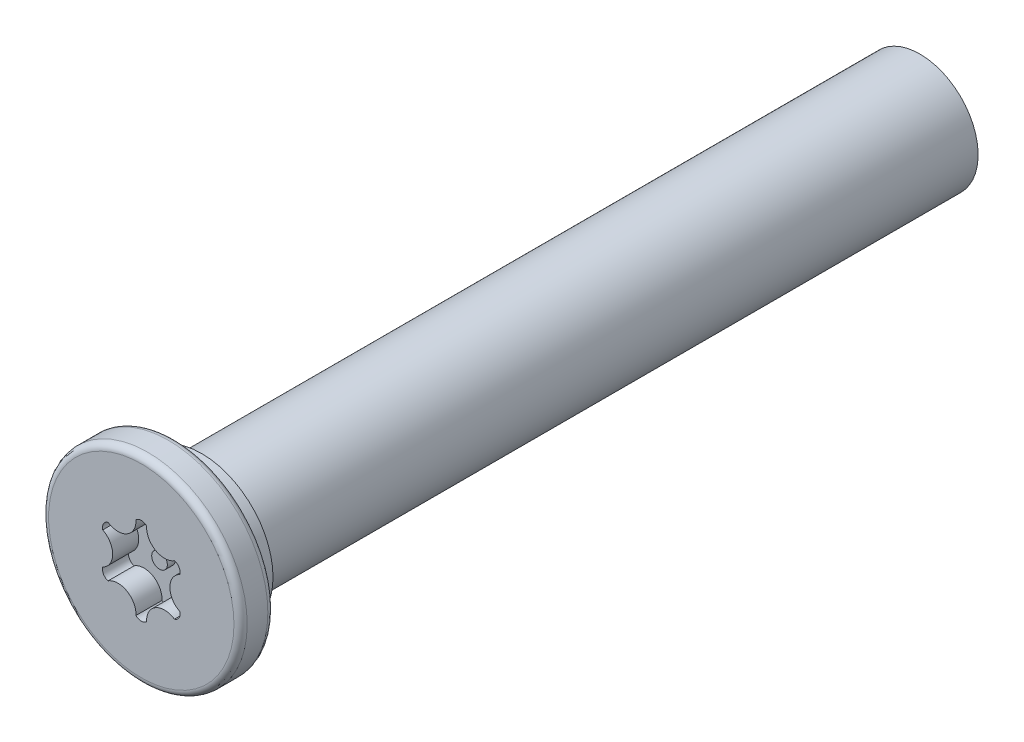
SolidWorks part; units mm, degrees
ref_plane "Front Plane" through (0, 0, 0) normal (0, 0, 1) x (1, 0, 0)
ref_plane "Top Plane" through (0, 0, 0) normal (0, 1, 0) x (1, 0, 0)
ref_plane "Right Plane" through (0, 0, 0) normal (1, 0, 0) x (0, 0, -1)
sketch "Sketch2" plane through (0, 0, 0) normal (1, 0, 0) x (0, 0, -1)
  line L1 (0, 0) -> (1.3, 0)
  line L2 (0, 0) -> (0, 3.81)
  line L3 (0, 3.81) -> (1.3, 3.81)
  line L4 (1.3, 0) -> (1.3, 3.81)
  line L5 (1.3, 0) -> (14, 0)
  line L6 (1.3, 0) -> (1.3, 2.23)
  line L7 (1.3, 2.23) -> (14, 2.23)
  line L8 (14, 0) -> (14, 2.23)
  dimension "D1" = 3.81
  dimension "D2" = 1.3
  dimension "D3" = 12.7
  dimension "D4" = 2.23
revolve "Revolve1" add sketch "Sketch2" angle 360 about L5
sketch "Sketch3" plane through (0, 0, 0) normal (0, 0, 1) x (1, 0, 0)
  line L0 (0, 1.3843) -> (0, 0)
  line L3 (1.1845, -1.0048) -> (2.4257, -1.0048)
  line L4 (0, 1.675) -> (0, 1.6727)
  line L5 (0, 1.675) -> (0, 1.6727)
  line L6 (0, 1.6727) -> (0, 1.675)
  line L8 (1.0407, 1.8026) -> (1.1012, 1.9073)
  line L9 (1.3857, 1.205) -> (2.5818, 1.205)
  line L10 (0, 0) -> (0.8375, 1.4506)
  line L11 (0, 0) -> (2.5818, 0)
  line L14 (2.5818, 0) -> (2.5818, 1.205)
  line L15 (1.3857, 1.205) -> (-0.1691, 1.205)
  circle A0 centre (0, 0) radius 1.675
  arc A7 (1.1845, -1.0048) -> (1.0345, -1.0748) centre (0.8546, -0.4934) cw
  arc A16 (-0.2051, 1.5894) -> (0.2051, 1.5894) centre (0, 1.3843) cw
  arc A18 (0.2051, 1.5894) -> (1.2739, 0.9723) centre (0.8938, 1.5482) ccw
  arc A19 (1.479, 0.6171) -> (1.479, -0.6171) centre (1.7877, 0) ccw
  arc A20 (1.2739, 0.9723) -> (1.479, 0.6171) centre (1.1988, 0.6922) cw
  arc A21 (1.2739, -0.9723) -> (0.2051, -1.5894) centre (0.8938, -1.5482) ccw
  arc A22 (1.479, -0.6171) -> (1.2739, -0.9723) centre (1.1988, -0.6922) cw
  arc A23 (-0.2051, -1.5894) -> (-1.2739, -0.9723) centre (-0.8938, -1.5482) ccw
  arc A24 (0.2051, -1.5894) -> (-0.2051, -1.5894) centre (0, -1.3843) cw
  arc A25 (-1.479, -0.6171) -> (-1.479, 0.6171) centre (-1.7877, 0) ccw
  arc A26 (-1.2739, -0.9723) -> (-1.479, -0.6171) centre (-1.1988, -0.6922) cw
  arc A27 (-1.2739, 0.9723) -> (-0.2051, 1.5894) centre (-0.8938, 1.5482) ccw
  arc A28 (-1.479, 0.6171) -> (-1.2739, 0.9723) centre (-1.1988, 0.6922) cw
  point P38 (0, 0)
  point P52 (0, 0)
  dimension "D1" = 3.35
  dimension "D4" = 1.205
  dimension "D2" = 6
  dimension "D5" = 60
extrude "Cut-Extrude3" cut sketch "Sketch3" against normal blind 1
fillet "Fillet12" radius 0.254 2 edges at (3.81, 0, 0) (3.81, 0, -1.3)
sketch "Sketch7" plane through (0, 0, -14) normal (0, 0, -1) x (-1, 0, 0)
  circle A0 centre (0, 0) radius 2.23
  dimension "D1" = 4.46
extrude "Cut-Extrude6" cut sketch "Sketch7" against normal blind 12.7
sketch "Sketch11" plane through (0, 0, -1.3) normal (0, 0, -1) x (-1, 0, 0)
  circle A0 centre (0, 0) radius 2.23
  circle A1 centre (0, 0) radius 2.738
extrude "Boss-Extrude1" add sketch "Sketch11" along normal blind 1.016
sketch "Sketch12" plane through (0, 0, -1.3) normal (0, 0, -1) x (-1, 0, 0)
  circle A0 centre (0, 0) radius 2.23
extrude "Boss-Extrude2" add sketch "Sketch12" along normal blind 12.7
sketch "Sketch14" plane through (0, 0, -1) normal (0, 0, 1) x (1, 0, 0)
  circle A0 centre (0, 0) radius 0.3
extrude "Boss-Extrude4" add sketch "Sketch14" along normal blind 0.3
sketch "Sketch15" plane through (0, 0, -14) normal (0, 0, -1) x (-1, 0, 0)
  circle A0 centre (0, 0) radius 2.23
extrude "Cut-Extrude7" cut sketch "Sketch15" against normal blind 12.7
sketch "Sketch16" plane through (0, 0, -1.3) normal (0, 0, -1) x (-1, 0, 0)
  circle A0 centre (0, 0) radius 2.23
extrude "Boss-Extrude5" add sketch "Sketch16" along normal blind 28.575
